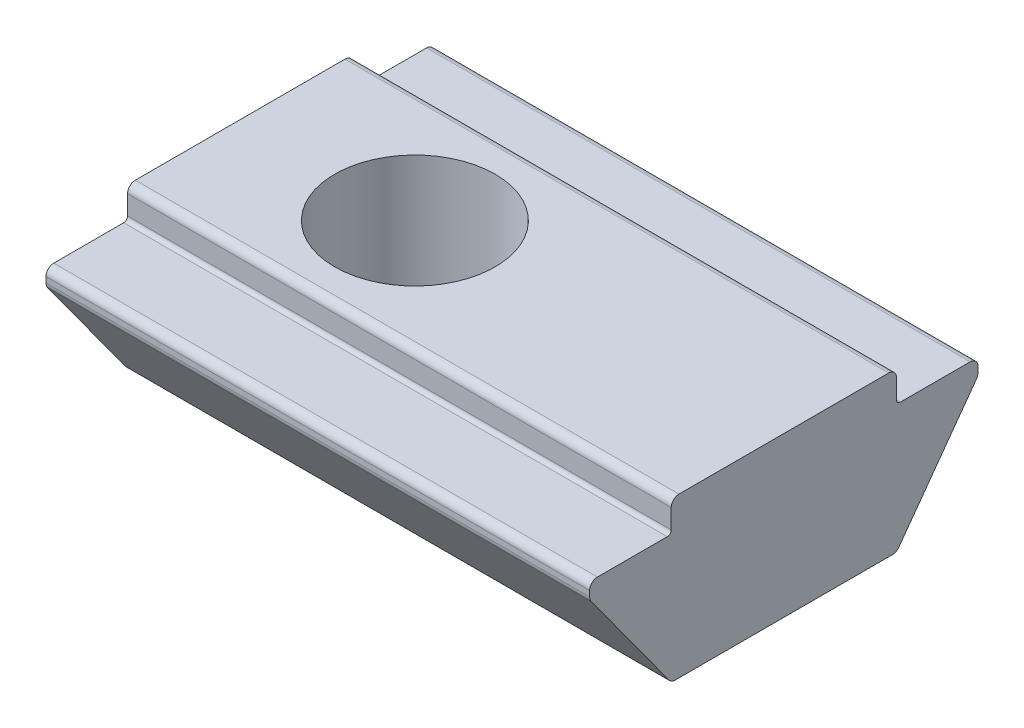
SolidWorks part; units mm, degrees
ref_plane "Front Plane" through (0, 0, 0) normal (0, 0, 1) x (1, 0, 0)
ref_plane "Top Plane" through (0, 0, 0) normal (0, 1, 0) x (1, 0, 0)
ref_plane "Right Plane" through (0, 0, 0) normal (1, 0, 0) x (0, 0, -1)
ref_plane "Plane1" through (-4.5, 0, 0) normal (1, 0, 0) x (0, 0, -1)
sketch "Sketch1" plane through (-4.5, 0, 0) normal (1, 0, 0) x (0, 0, -1)
  line L0 (2.9, -3.3) -> (-2.9, -3.3)
  line L1 (-5, 0) -> (-5, -0.4096)
  line L2 (-5, 0) -> (-2.9, 0)
  line L3 (-2.9, 0) -> (-2.9, 0.8)
  line L4 (-2.9, 0.8) -> (2.9, 0.8)
  line L5 (2.9, 0.8) -> (2.9, 0)
  line L6 (2.9, 0) -> (5, 0)
  line L7 (5, 0) -> (5, -0.4096)
  line L8 (5, -0.4096) -> (2.9, -3.3)
  line L9 (0, 0.8) -> (0, -3.3) construction
  line L10 (-5, -0.4096) -> (-2.9, -3.3)
  point P0 (-3.95, 0)
  point P15 (-5, 0)
  point P18 (-5, -0.4096)
  point P21 (-2.9, -3.3)
  point P24 (2.9, -3.3)
  point P27 (5, -0.4096)
  point P30 (5, 0)
  dimension "FIX_2" = 5.8
  dimension "FIX_3" = 4.1
  dimension "FIX_6" = 5.8
  dimension "FIX_4" = 10
  dimension "FIX_5" = 3.3
  dimension "FIX_7" = 54
extrude "Boss-Extrude1" add sketch "Sketch1" along normal blind 14
fillet "Fillet1" radius 0.1 2 edges at (2.5, 0, -2.9) (2.5, 0, 2.9)
fillet "Fillet2" radius 0.2 8 edges at (2.5, 0.8, -2.9) (2.5, 0.8, 2.9) (2.5, 0, -5) (2.5, 0, 5) (2.5, -0.4096, -5) (2.5, -0.4096, 5) (2.5, -3.3, -2.9) (2.5, -3.3, 2.9)
ref_plane "Plane2" through (6, 0, 0) normal (1, 0, 0) x (0, 0, -1)
sketch "Sketch2" plane through (6, 0, 0) normal (1, 0, 0) x (0, 0, -1)
  line L0 (0, 0) -> (0, -3.3) construction
  line L1 (0, -3.3) -> (1.75, -3.3)
  line L2 (1.75, -3.3) -> (1.75, -2.25)
  line L3 (1.75, -2.25) -> (0, -2.25)
  line L4 (0, -3.3) -> (0, -2.25)
  dimension "FIX_13" = 3.5
  dimension "FIX_12" = 1.05
revolve "Cut-Revolve1" cut sketch "Sketch2" angle 360 about L0
sketch "Sketch3" plane through (6, 0, 0) normal (1, 0, 0) x (0, 0, -1)
  line L0 (0, 0) -> (0, -4) construction
  line L1 (-1.75, -2.25) -> (0, -2.25)
  line L2 (0, -4) -> (0, -2.25)
  arc A0 (-1.75, -2.25) -> (0, -4) centre (0, -2.25) ccw
  dimension "FIX_16" = 1.75
  dimension "FIX_15" = 4
revolve "Revolve1" add sketch "Sketch3" angle 360 about L0
hole_wizard "Tap1" positions "Sketch5" profile "Sketch4" hole size "M5x0.8" standard "JIS"
sketch "Sketch5" plane through (0, 0.8, 0) normal (0, 1, 0) x (1, 0, 0)
  point P0 (0, 0)
sketch "Sketch4" plane through (0, 0.8, 0) normal (1, 0, 0) x (0, 0, 1)
  line L0 (0, 0) -> (0, 4.8)
  line L1 (0, 4.8) -> (2.067, 4.8)
  line L2 (2.067, 4.8) -> (2.067, 0)
  line L5 (2.067, 0) -> (0, 0)
  line L11 (0, 0) -> (0, 4.8) construction
  dimension "Thru Hole Dia." = 4.134
  dimension "Thru Hole Depth" = 4.8
ref_plane "Plane3" [suppressed] through (-5, 0, 0) normal (1, 0, 0) x (0, 0, -1)
sketch "Sketch6" [suppressed] plane through (-5, 0, 0) normal (1, 0, 0) x (0, 0, -1)
  line L0 (5, -6) -> (-5, -6)
  line L1 (-7.5, 0) -> (-7.5, -3.5)
  line L2 (-7.5, 0) -> (-3.9, 0)
  line L3 (-3.9, 0) -> (-3.9, 0.8)
  line L4 (-3.9, 0.8) -> (3.9, 0.8)
  line L5 (3.9, 0.8) -> (3.9, 0)
  line L6 (3.9, 0) -> (7.5, 0)
  line L7 (7.5, 0) -> (7.5, -3.5)
  line L8 (7.5, -3.5) -> (5, -6)
  line L9 (0, 0.8) -> (0, -6) construction
  line L10 (-7.5, -3.5) -> (-5, -6)
  point P0 (-5.7, 0)
  point P15 (-7.5, 0)
  point P18 (-7.5, -3.5)
  point P21 (-5, -6)
  point P24 (5, -6)
  point P27 (7.5, -3.5)
  point P30 (7.5, 0)
  dimension "FIX_19" = 7.8
  dimension "FIX_20" = 6.8
  dimension "FIX_21" = 15
  dimension "FIX_22" = 6
  dimension "FIX_23" = 10
  dimension "FIX_24" = 45
extrude "Boss-Extrude2" [suppressed] add sketch "Sketch6" along normal blind 16 separate body
fillet "Fillet3" [suppressed] radius 0.1
fillet "Fillet4" [suppressed] radius 0.5
fillet "Fillet5" [suppressed] radius 1
ref_plane "Plane4" [suppressed] through (7, 0, 0) normal (1, 0, 0) x (0, 0, -1)
sketch "Sketch7" [suppressed] plane through (7, 0, 0) normal (1, 0, 0) x (0, 0, -1)
  line L0 (0, 0) -> (0, -6) construction
  line L1 (0, -6) -> (2.25, -6)
  line L2 (2.25, -6) -> (2.25, -4.75)
  line L3 (2.25, -4.75) -> (0, -4.75)
  line L4 (0, -6) -> (0, -4.75)
  dimension "FIX_30" = 1.25
  dimension "FIX_31" = 4.5
revolve "Cut-Revolve2" [suppressed] cut sketch "Sketch7" angle 360 about L0
sketch "Sketch8" [suppressed] plane through (7, 0, 0) normal (1, 0, 0) x (0, 0, -1)
  line L0 (0, 0) -> (0, -7) construction
  line L1 (-2.25, -4.75) -> (0, -4.75)
  line L2 (0, -7) -> (0, -4.75)
  arc A0 (-2.25, -4.75) -> (0, -7) centre (0, -4.75) ccw
  dimension "FIX_34" = 2.25
  dimension "FIX_33" = 7
revolve "Revolve2" [suppressed] add sketch "Sketch8" angle 360 about L0
hole_wizard "Tap2" positions "Sketch10" profile "Sketch9" hole size "M6x1.0" standard "JIS"
sketch "Sketch10" [suppressed] plane through (0, 0.8, 0) normal (0, 1, 0) x (1, 0, 0)
  point P0 (0, 0)
sketch "Sketch9" [suppressed] plane through (0, 0.8, 0) normal (1, 0, 0) x (0, 0, 1)
  line L0 (0, 0) -> (0, 7.8)
  line L1 (0, 7.8) -> (2.4585, 7.8)
  line L2 (2.4585, 7.8) -> (2.4585, 0)
  line L5 (2.4585, 0) -> (0, 0)
  line L11 (0, 0) -> (0, 7.8) construction
  dimension "Thru Hole Dia." = 4.917
  dimension "Thru Hole Depth" = 7.8
ref_plane "Plane5" [suppressed] through (-6, 0, 0) normal (1, 0, 0) x (0, 0, -1)
sketch "Sketch11" [suppressed] plane through (-6, 0, 0) normal (1, 0, 0) x (0, 0, -1)
  line L0 (5, -6) -> (-5, -6)
  line L1 (-8.5, 0) -> (-8.5, -1.1827)
  line L2 (-8.5, 0) -> (-4.9, 0)
  line L3 (-4.9, 0) -> (-4.9, 3)
  line L4 (-4.9, 3) -> (4.9, 3)
  line L5 (4.9, 3) -> (4.9, 0)
  line L6 (4.9, 0) -> (8.5, 0)
  line L7 (8.5, 0) -> (8.5, -1.1827)
  line L8 (8.5, -1.1827) -> (5, -6)
  line L9 (0, 3) -> (0, -6) construction
  line L10 (-8.5, -1.1827) -> (-5, -6)
  point P0 (-6.7, 0)
  point P15 (-8.5, 0)
  point P18 (-8.5, -1.1827)
  point P21 (-5, -6)
  point P24 (5, -6)
  point P27 (8.5, -1.1827)
  point P30 (8.5, 0)
  dimension "FIX_37" = 9.8
  dimension "FIX_38" = 9
  dimension "FIX_39" = 17
  dimension "FIX_40" = 6
  dimension "FIX_41" = 10
  dimension "FIX_42" = 54
extrude "Boss-Extrude3" [suppressed] add sketch "Sketch11" along normal blind 18 separate body
fillet "Fillet6" [suppressed] radius 0.1
fillet "Fillet7" [suppressed] radius 0.5
ref_plane "Plane6" [suppressed] through (8, 0, 0) normal (1, 0, 0) x (0, 0, -1)
sketch "Sketch12" [suppressed] plane through (8, 0, 0) normal (1, 0, 0) x (0, 0, -1)
  line L0 (0, 0) -> (0, -6) construction
  line L1 (0, -6) -> (2.25, -6)
  line L2 (2.25, -6) -> (2.25, -4.75)
  line L3 (2.25, -4.75) -> (0, -4.75)
  line L4 (0, -6) -> (0, -4.75)
  dimension "FIX_47" = 1.25
  dimension "FIX_48" = 4.5
revolve "Cut-Revolve3" [suppressed] cut sketch "Sketch12" angle 360 about L0
sketch "Sketch13" [suppressed] plane through (8, 0, 0) normal (1, 0, 0) x (0, 0, -1)
  line L0 (0, 0) -> (0, -7) construction
  line L1 (-2.25, -4.75) -> (0, -4.75)
  line L2 (0, -7) -> (0, -4.75)
  arc A0 (-2.25, -4.75) -> (0, -7) centre (0, -4.75) ccw
  dimension "FIX_51" = 2.25
  dimension "FIX_50" = 7
revolve "Revolve3" [suppressed] add sketch "Sketch13" angle 360 about L0
hole_wizard "Tap3" positions "Sketch15" profile "Sketch14" hole size "M8x1.25" standard "JIS"
sketch "Sketch15" [suppressed] plane through (0, 3, 0) normal (0, 1, 0) x (1, 0, 0)
  point P0 (0, 0)
sketch "Sketch14" [suppressed] plane through (0, 3, 0) normal (1, 0, 0) x (0, 0, 1)
  line L0 (0, 0) -> (0, 10)
  line L1 (0, 10) -> (3.3235, 10)
  line L2 (3.3235, 10) -> (3.3235, 0)
  line L5 (3.3235, 0) -> (0, 0)
  line L11 (0, 0) -> (0, 10) construction
  dimension "Thru Hole Dia." = 6.647
  dimension "Thru Hole Depth" = 10
